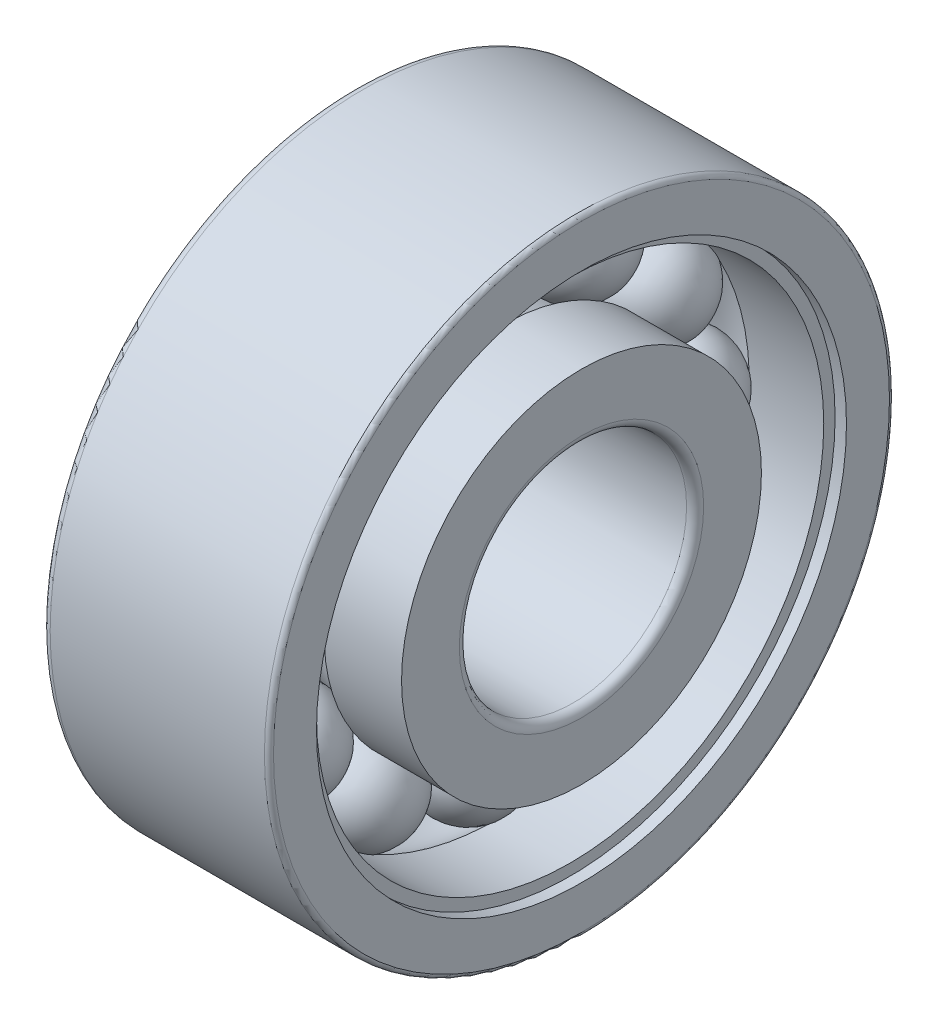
SolidWorks part; units mm, degrees
ref_plane "Front" through (0, 0, 0) normal (0, 0, 1) x (1, 0, 0)
ref_plane "Top" through (0, 0, 0) normal (0, 1, 0) x (1, 0, 0)
ref_plane "Right" through (0, 0, 0) normal (1, 0, 0) x (0, 0, -1)
other "Configuration Table"
sketch "Sketch1" plane through (0, 0, 0) normal (0, 0, 1) x (1, 0, 0)
  line L0 (-3.0919, 0) -> (2.899, 0) construction
  line L1 (-3.0919, 3.75) -> (2.899, 3.75) construction
  line L2 (-0.875, 3.75) -> (0.875, 3.75)
  arc A0 (-0.875, 3.75) -> (0.875, 3.75) centre (0, 3.75) ccw
revolve "Revolve1" add sketch "Sketch1" angle 360 about L1
sketch "Sketch2" plane through (0, 0, 0) normal (0, 0, 1) x (1, 0, 0)
  line L0 (-2, 3.1667) -> (-0.6387, 3.1667)
  line L1 (2, 3.1667) -> (2, 2)
  line L2 (2, 2) -> (-2, 2)
  line L3 (-2, 2) -> (-2, 3.1667)
  line L4 (-2.9924, 0) -> (3.9982, 0) construction
  line L5 (-1.8743, 3.75) -> (3.1755, 3.75) construction
  line L7 (0.6387, 3.1667) -> (2, 3.1667)
  line L8 (-2, 6.2861) -> (-2, 1.454) construction
  arc A0 (-0.6387, 3.1667) -> (0.6387, 3.1667) centre (0, 3.75) ccw
revolve "Revolve2" add sketch "Sketch2" angle 360 about L4
sketch "Sketch3" plane through (0, 0, 0) normal (0, 0, 1) x (1, 0, 0)
  line L0 (-2, 4.3333) -> (-2, 5.5)
  line L1 (-2, 5.5) -> (2, 5.5)
  line L2 (2, 5.5) -> (2, 4.6633)
  line L3 (1.8, 4.4633) -> (0.4893, 4.4633)
  line L4 (-2.9924, 0) -> (3.4329, 0) construction
  line L6 (-1.7375, 3.75) -> (2.2712, 3.75) construction
  line L7 (-0.6387, 4.3333) -> (-2, 4.3333)
  line L8 (1.8, 4.4633) -> (1.8, 4.6633)
  line L9 (1.8, 4.6633) -> (2, 4.6633)
  arc A0 (0.4893, 4.4633) -> (-0.6387, 4.3333) centre (0, 3.75) ccw
revolve "Revolve3" add sketch "Sketch3" angle 360 about L4
pattern_circular "Circular-Pattern1" count 12 over 360 about axis through (0, 0, 0) along (1, 0, 0) of "Revolve1"
fillet "Fillet1" radius 0.15 2 edges at (2, 0, 2) (-2, 0, 5.5)
fillet "Fillet2" radius 0.08 2 edges at (2, 0, 5.5) (-2, 0, 2)
equation "\"R@Sketch1\" =  ( \"DD@Sketch3\" - \"d@Sketch2\" )  / 8"
equation "\"D1@Sketch1\"=(\"d@Sketch2\"+\"DD@Sketch3\")/4"
equation "\"D1@Sketch2\"=(\"d@Sketch2\"+\"DD@Sketch3\")/4"
equation "\"D3@Sketch2\" =  \"d@Sketch2\"+  ( \"DD@Sketch3\" - \"d@Sketch2\" )  /3"
equation "\"D2@Sketch2\" =  ( \"DD@Sketch3\" - \"d@Sketch2\" )  / 8 - 0.01"
equation "\"D6@Sketch2\" = \"B@Sketch2\" / 2"
equation "\"B@Sketch3\" = \"B@Sketch2\""
equation "\"D2@Sketch3\" = \"B@Sketch3\" / 2"
equation "\"D1@Sketch3\"=(\"d@Sketch2\"+\"DD@Sketch3\")/4"
equation "\"D3@Sketch3\" = (  \"DD@Sketch3\" -  (\"DD@Sketch3\" - \"d@Sketch2\"  )  / 3 )  * 1.03"
equation "\"D5@Sketch3\" = \"DD@Sketch3\" -  (  \"DD@Sketch3\" - \"d@Sketch2\")  / 3"
equation "\"D6@Sketch3\" = \"d@Sketch2\" / 20"
equation "\"D7@Sketch3\"=\"D6@Sketch3\""
equation "\"D4@Sketch3\"=(\"DD@Sketch3\"-\"d@Sketch2\")/8-0.01"
equation "\"m@Circular-Pattern1\" = int( 3.14159265 / atn(\"R@Sketch1\" / sqr((\"d@Sketch2\"+\"DD@Sketch3\")/4 * (\"d@Sketch2\"+\"DD@Sketch3\")/4 - \"R@Sketch1\" *  \"R@Sketch1\")))-1"
